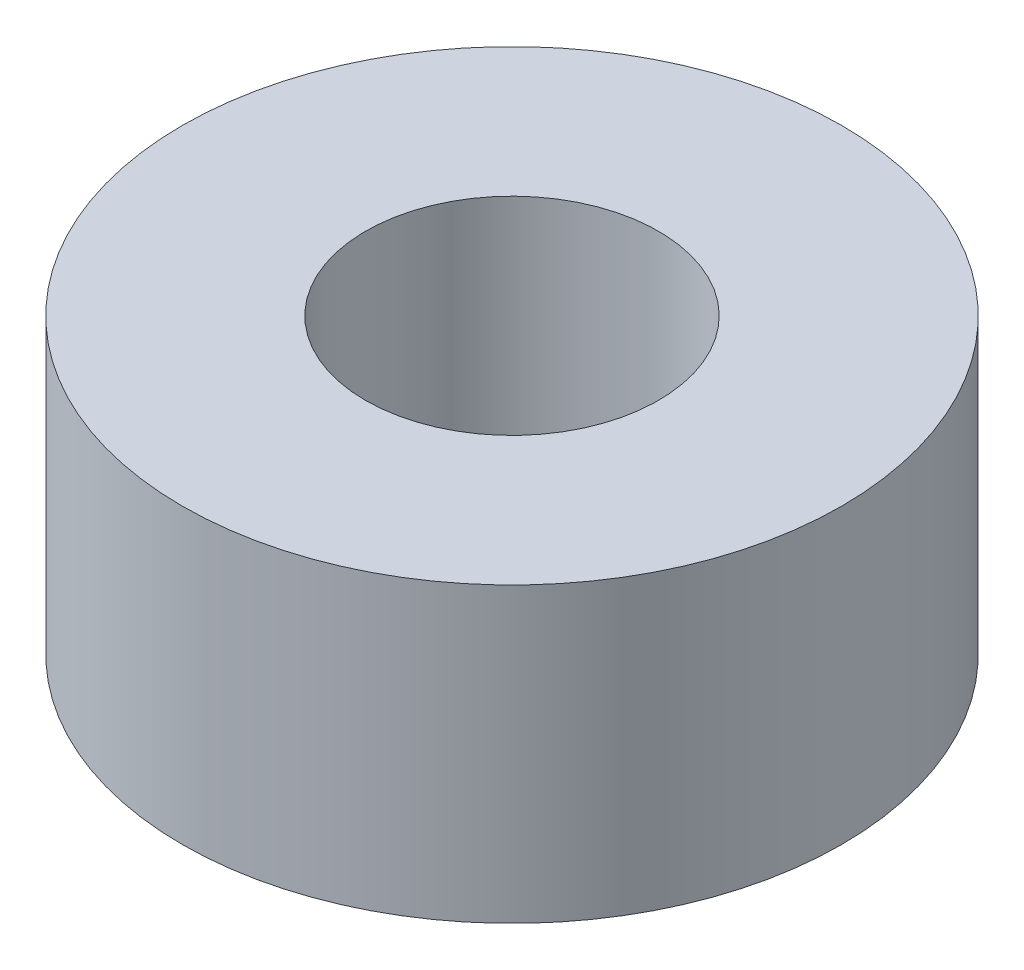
SolidWorks part; units mm, degrees
ref_plane "前视基准面" through (0, 0, 0) normal (0, 0, 1) x (1, 0, 0)
ref_plane "上视基准面" through (0, 0, 0) normal (0, 1, 0) x (1, 0, 0)
ref_plane "右视基准面" through (0, 0, 0) normal (1, 0, 0) x (0, 0, -1)
sketch "草图1" plane through (0, 0, 0) normal (0, 1, 0) x (1, 0, 0)
  circle A0 centre (0, 0) radius 4.5
  circle A1 centre (0, 0) radius 2
  dimension "D1" = 9
  dimension "D2" = 4
extrude "凸台-拉伸1" add sketch "草图1" along normal blind 4
